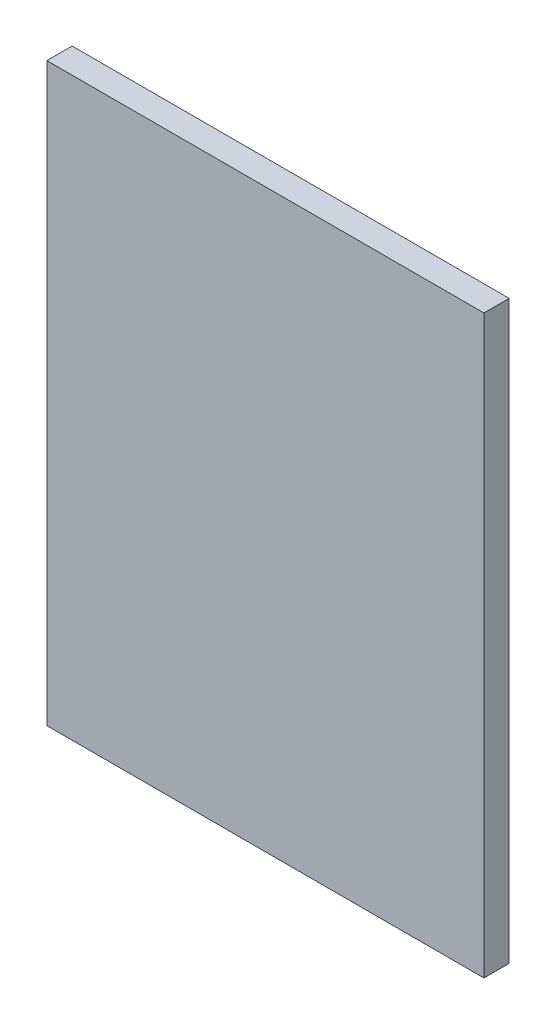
SolidWorks part; units mm, degrees
ref_plane "Спереди" through (0, 0, 0) normal (0, 0, 1) x (1, 0, 0)
ref_plane "Сверху" through (0, 0, 0) normal (0, 1, 0) x (1, 0, 0)
ref_plane "Справа" through (0, 0, 0) normal (1, 0, 0) x (0, 0, -1)
sketch "Эскиз1" plane through (0, 0, 0) normal (0, 0, 1) x (1, 0, 0)
  line L1 (0, 0) -> (277, 0)
  line L2 (0, 0) -> (0, -365)
  line L3 (0, -365) -> (277, -365)
  line L4 (277, 0) -> (277, -365)
  dimension "D1" = 277
  dimension "D2" = 365
extrude "Вытянуть1" add sketch "Эскиз1" along normal blind 16
